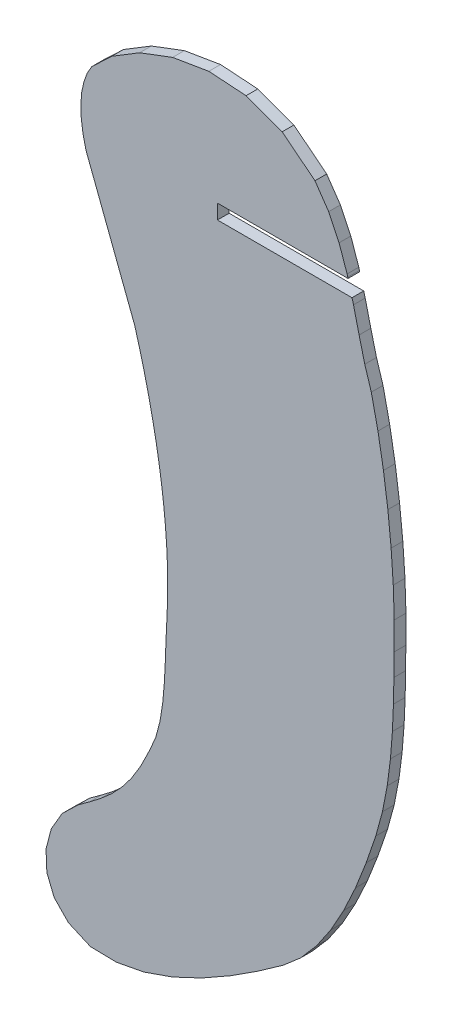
SolidWorks part; units mm, degrees
ref_plane "Спереди" through (0, 0, 0) normal (0, 0, 1) x (1, 0, 0)
ref_plane "Сверху" through (0, 0, 0) normal (0, 1, 0) x (1, 0, 0)
ref_plane "Справа" through (0, 0, 0) normal (1, 0, 0) x (0, 0, -1)
sketch "Model" plane through (0, 0, 0) normal (0, 0, 1) x (1, 0, 0)
  line L0 (-5730.1433, 33.3463) -> (-5730.2722, 36.082)
  line L1 (-5730.2722, 36.082) -> (-5730.4781, 38.869)
  line L2 (-5730.4781, 38.869) -> (-5730.76, 41.7033)
  line L3 (-5730.76, 41.7033) -> (-5731.1165, 44.5811)
  line L4 (-5731.1165, 44.5811) -> (-5731.5559, 47.5547)
  line L5 (-5731.5559, 47.5547) -> (-5732.0706, 50.5647)
  line L6 (-5732.0706, 50.5647) -> (-5732.6597, 53.6068)
  line L7 (-5732.6597, 53.6068) -> (-5733.322, 56.6767)
  line L8 (-5733.322, 56.6767) -> (-5734.0564, 59.77)
  line L9 (-5734.0564, 59.77) -> (-5734.8618, 62.8825)
  line L10 (-5734.8618, 62.8825) -> (-5735.7368, 66.0098)
  line L11 (-5735.7368, 66.0098) -> (-5744.0505, 87.7221)
  line L12 (-5744.0505, 87.7221) -> (-5744.5685, 89.955)
  line L13 (-5744.5685, 89.955) -> (-5744.8594, 92.0816)
  line L14 (-5744.8594, 92.0816) -> (-5744.9277, 94.0866)
  line L15 (-5744.9277, 94.0866) -> (-5744.7791, 95.9551)
  line L16 (-5744.7791, 95.9551) -> (-5744.418, 97.6716)
  line L17 (-5744.418, 97.6716) -> (-5743.8494, 99.221)
  line L18 (-5743.8494, 99.221) -> (-5743.0781, 100.588)
  line L19 (-5743.0781, 100.588) -> (-5739.6255, 103.8516)
  line L20 (-5739.6255, 103.8516) -> (-5734.8955, 106.7323)
  line L21 (-5734.8955, 106.7323) -> (-5729.2559, 108.8697)
  line L22 (-5729.2559, 108.8697) -> (-5723.0735, 109.9029)
  line L23 (-5723.0735, 109.9029) -> (-5716.7163, 109.472)
  line L24 (-5716.7163, 109.472) -> (-5710.5513, 107.216)
  line L25 (-5710.5513, 107.216) -> (-5704.9459, 102.7748)
  line L26 (-5704.9459, 102.7748) -> (-5702.6106, 99.3804)
  line L27 (-5702.6106, 99.3804) -> (-5700.83, 95.6608)
  line L28 (-5700.83, 95.6608) -> (-5699.4635, 91.7341)
  line L29 (-5699.4635, 91.7341) -> (-5699.349, 91.3135)
  line L30 (-5699.349, 91.3135) -> (-5699.3026, 91.1428)
  line L31 (-5699.3026, 91.1428) -> (-5721.6055, 91.1428)
  line L32 (-5721.6055, 91.1428) -> (-5721.6055, 90.8928)
  line L33 (-5721.6055, 90.8928) -> (-5721.6055, 88.8928)
  line L34 (-5721.6055, 88.8928) -> (-5721.6055, 88.6428)
  line L35 (-5721.6055, 88.6428) -> (-5698.6222, 88.6428)
  line L36 (-5698.6222, 88.6428) -> (-5698.3706, 87.7185)
  line L37 (-5698.3706, 87.7185) -> (-5697.4106, 83.7319)
  line L38 (-5697.4106, 83.7319) -> (-5696.4434, 79.8927)
  line L39 (-5696.4434, 79.8927) -> (-5695.3276, 76.3192)
  line L40 (-5695.3276, 76.3192) -> (-5694.1934, 71.1404)
  line L41 (-5694.1934, 71.1404) -> (-5693.2507, 65.7874)
  line L42 (-5693.2507, 65.7874) -> (-5692.5005, 60.3582)
  line L43 (-5692.5005, 60.3582) -> (-5691.943, 54.9503)
  line L44 (-5691.943, 54.9503) -> (-5691.5789, 49.6622)
  line L45 (-5691.5789, 49.6622) -> (-5691.4089, 44.5917)
  line L46 (-5691.4089, 44.5917) -> (-5691.4333, 39.8372)
  line L47 (-5691.4333, 39.8372) -> (-5691.4697, 36.0481)
  line L48 (-5691.4697, 36.0481) -> (-5691.5485, 32.063)
  line L49 (-5691.5485, 32.063) -> (-5691.7263, 27.9349)
  line L50 (-5691.7263, 27.9349) -> (-5692.0598, 23.7169)
  line L51 (-5692.0598, 23.7169) -> (-5692.6061, 19.4622)
  line L52 (-5692.6061, 19.4622) -> (-5693.4216, 15.224)
  line L53 (-5693.4216, 15.224) -> (-5694.5632, 11.0555)
  line L54 (-5694.5632, 11.0555) -> (-5696.2051, 6.2693)
  line L55 (-5696.2051, 6.2693) -> (-5698.0206, 1.6706)
  line L56 (-5698.0206, 1.6706) -> (-5700.0291, -2.6678)
  line L57 (-5700.0291, -2.6678) -> (-5702.25, -6.6736)
  line L58 (-5702.25, -6.6736) -> (-5704.7029, -10.274)
  line L59 (-5704.7029, -10.274) -> (-5707.4072, -13.3965)
  line L60 (-5707.4072, -13.3965) -> (-5710.3821, -15.9683)
  line L61 (-5710.3821, -15.9683) -> (-5714.7405, -19.034)
  line L62 (-5714.7405, -19.034) -> (-5719.4209, -22.0456)
  line L63 (-5719.4209, -22.0456) -> (-5724.2991, -24.8138)
  line L64 (-5724.2991, -24.8138) -> (-5729.2507, -27.1491)
  line L65 (-5729.2507, -27.1491) -> (-5734.1514, -28.862)
  line L66 (-5734.1514, -28.862) -> (-5738.8767, -29.7634)
  line L67 (-5738.8767, -29.7634) -> (-5743.302, -29.6635)
  line L68 (-5743.302, -29.6635) -> (-5747.0359, -28.0212)
  line L69 (-5747.0359, -28.0212) -> (-5749.4876, -25.511)
  line L70 (-5749.4876, -25.511) -> (-5750.7401, -22.4138)
  line L71 (-5750.7401, -22.4138) -> (-5750.8771, -19.0106)
  line L72 (-5750.8771, -19.0106) -> (-5749.9813, -15.5826)
  line L73 (-5749.9813, -15.5826) -> (-5748.1363, -12.411)
  line L74 (-5748.1363, -12.411) -> (-5745.4249, -9.7765)
  line L75 (-5745.4249, -9.7765) -> (-5743.4102, -8.3056)
  line L76 (-5743.4102, -8.3056) -> (-5741.5103, -6.8437)
  line L77 (-5741.5103, -6.8437) -> (-5739.709, -5.272)
  line L78 (-5739.709, -5.272) -> (-5737.9895, -3.4725)
  line L79 (-5737.9895, -3.4725) -> (-5736.3352, -1.3262)
  line L80 (-5736.3352, -1.3262) -> (-5734.7295, 1.285)
  line L81 (-5734.7295, 1.285) -> (-5733.1559, 4.48)
  line L82 (-5733.1559, 4.48) -> (-5732.1206, 6.9024)
  line L83 (-5732.1206, 6.9024) -> (-5731.4089, 9.6089)
  line L84 (-5731.4089, 9.6089) -> (-5730.9502, 12.5448)
  line L85 (-5730.9502, 12.5448) -> (-5730.6738, 15.6553)
  line L86 (-5730.6738, 15.6553) -> (-5730.5085, 18.8861)
  line L87 (-5730.5085, 18.8861) -> (-5730.3838, 22.1823)
  line L88 (-5730.3838, 22.1823) -> (-5730.2285, 25.4895)
  line L89 (-5730.2285, 25.4895) -> (-5730.1204, 28.0461)
  line L90 (-5730.1204, 28.0461) -> (-5730.0923, 30.6663)
  line L91 (-5730.0923, 30.6663) -> (-5730.1433, 33.3463)
extrude "Бобышка-Вытянуть1" add sketch "Model" along normal blind 2
